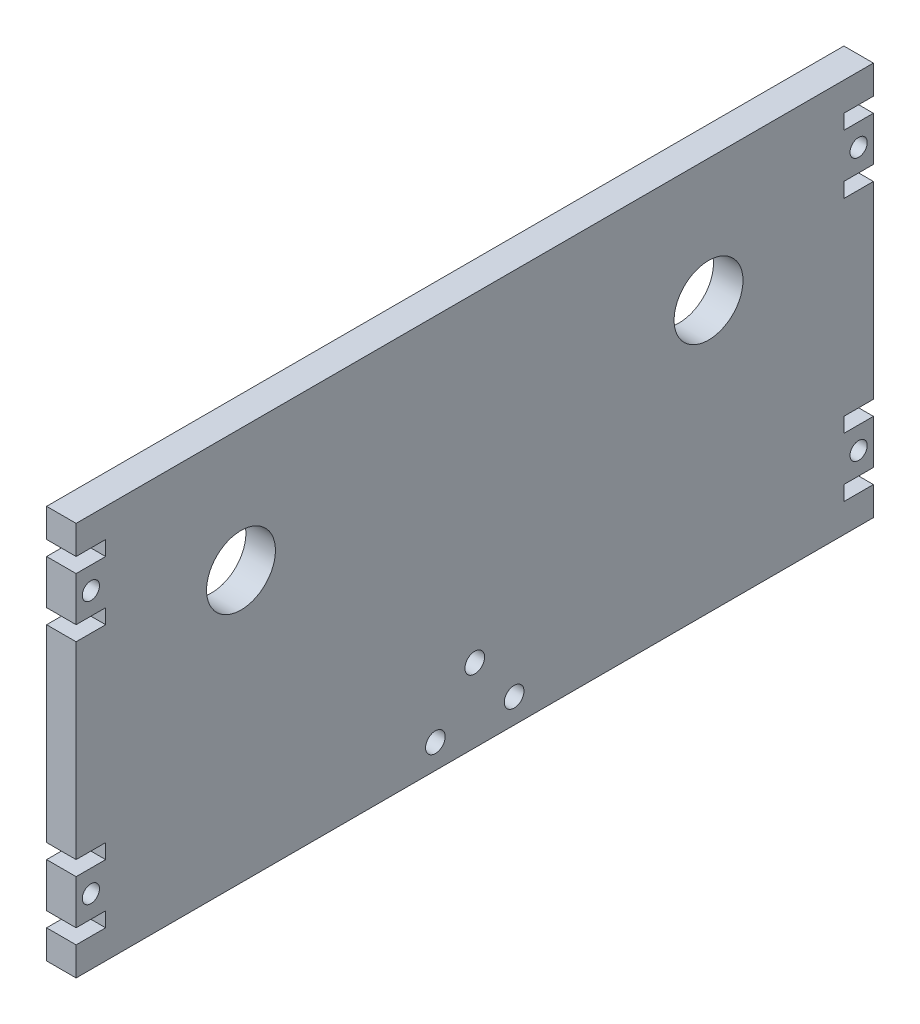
SolidWorks part; units mm, degrees
ref_plane "Front Plane" through (0, 0, 0) normal (0, 0, 1) x (1, 0, 0)
ref_plane "Top Plane" through (0, 0, 0) normal (0, 1, 0) x (1, 0, 0)
ref_plane "Right Plane" through (0, 0, 0) normal (1, 0, 0) x (0, 0, -1)
sketch "Sketch1" plane through (0, 0, 0) normal (1, 0, 0) x (0, 0, -1)
  line L1 (81, -40) -> (-81, -40)
  line L2 (81, -40) -> (81, 40)
  line L3 (81, 40) -> (-81, 40)
  line L4 (-81, -40) -> (-81, 40)
  line L5 (81, -40) -> (-81, 40) construction
  line L6 (81, 40) -> (-81, -40) construction
  point P0 (0, 0)
  dimension "D1" = 162
  dimension "D2" = 80
extrude "Boss-Extrude1" add sketch "Sketch1" along normal mid plane 6
sketch "Sketch2" plane through (3, 0, 0) normal (1, 0, 0) x (0, 0, -1)
  line L0 (0, -40) -> (0, 15) construction
  line L1 (-81, -40) -> (81, -40) construction
  line L2 (-47.5, 15) -> (47.5, 15) construction
  circle A0 centre (-47.5, 15) radius 7
  circle A1 centre (47.5, 15) radius 7
  point P8 (0, 15)
  dimension "D3" = 14
  dimension "D1" = 55
  dimension "D2" = 95
extrude "Cut-Extrude1" cut sketch "Sketch2" against normal through all
sketch "Sketch3" plane through (3, 0, 0) normal (1, 0, 0) x (0, 0, -1)
  line L0 (0, -40) -> (0, -35) construction
  line L1 (-81, -40) -> (81, -40) construction
  line L2 (0, -35) -> (0, -25) construction
  line L3 (8, -35) -> (-8, -35) construction
  circle A0 centre (-8, -35) radius 2
  circle A1 centre (8, -35) radius 2
  circle A2 centre (0, -25) radius 2
  point P9 (0, -35)
  dimension "D4" = 4
  dimension "D1" = 5
  dimension "D2" = 10
  dimension "D3" = 16
extrude "Cut-Extrude2" cut sketch "Sketch3" against normal through all
sketch "Sketch4" plane through (3, 0, 0) normal (1, 0, 0) x (0, 0, -1)
  line L0 (-75, 40) -> (-75, -40) construction
  line L1 (81, 40) -> (-81, 40) construction
  line L2 (-81, -40) -> (81, -40) construction
  line L3 (0, 0) -> (0, 40) construction
  line L4 (-81, 40) -> (-81, -40) construction
  line L5 (-75, 40) -> (-81, 40) construction
  line L6 (-78, 40) -> (-78, -40) construction
  line L7 (-78, 26.6667) -> (-75, 26.6667) construction
  line L8 (-81, 34.1667) -> (-75, 34.1667)
  line L9 (-81, 34.1667) -> (-81, 31.1667)
  line L10 (-81, 31.1667) -> (-75, 31.1667)
  line L11 (-75, 34.1667) -> (-75, 31.1667)
  line L12 (-81, 22.1667) -> (-75, 22.1667)
  line L13 (-75, 19.1667) -> (-75, 22.1667)
  line L14 (-81, 19.1667) -> (-75, 19.1667)
  line L15 (-81, 19.1667) -> (-81, 22.1667)
  line L16 (0, 0) -> (-81, 0) construction
  line L17 (-81, -19.1667) -> (-81, -22.1667)
  line L18 (-81, -19.1667) -> (-75, -19.1667)
  line L19 (-75, -19.1667) -> (-75, -22.1667)
  line L20 (-81, -22.1667) -> (-75, -22.1667)
  line L21 (-81, -31.1667) -> (-75, -31.1667)
  line L22 (-75, -34.1667) -> (-75, -31.1667)
  line L23 (-81, -34.1667) -> (-75, -34.1667)
  line L24 (-81, -34.1667) -> (-81, -31.1667)
  line L25 (81, -34.1667) -> (81, -31.1667)
  line L26 (81, -34.1667) -> (75, -34.1667)
  line L27 (75, -34.1667) -> (75, -31.1667)
  line L28 (81, -31.1667) -> (75, -31.1667)
  line L29 (81, -19.1667) -> (75, -19.1667)
  line L30 (75, -19.1667) -> (75, -22.1667)
  line L31 (81, -22.1667) -> (75, -22.1667)
  line L32 (81, -19.1667) -> (81, -22.1667)
  line L33 (81, 19.1667) -> (81, 22.1667)
  line L34 (81, 19.1667) -> (75, 19.1667)
  line L35 (75, 19.1667) -> (75, 22.1667)
  line L36 (81, 22.1667) -> (75, 22.1667)
  line L37 (81, 31.1667) -> (75, 31.1667)
  line L38 (75, 34.1667) -> (75, 31.1667)
  line L39 (81, 34.1667) -> (75, 34.1667)
  line L40 (81, 34.1667) -> (81, 31.1667)
  circle A0 centre (-78, 26.6667) radius 1.75
  circle A1 centre (-78, -26.6667) radius 1.75
  circle A4 centre (78, -26.6667) radius 1.75
  circle A5 centre (78, 26.6667) radius 1.75
  point P28 (-75, 32.6667)
extrude "Cut-Extrude3" cut sketch "Sketch4" against normal through all
equation "\"D3@Sketch4\"=(\"D2@Sketch4\"/3)/2"
equation "\"D4@Sketch4\"=\"D3@Sketch4\""
